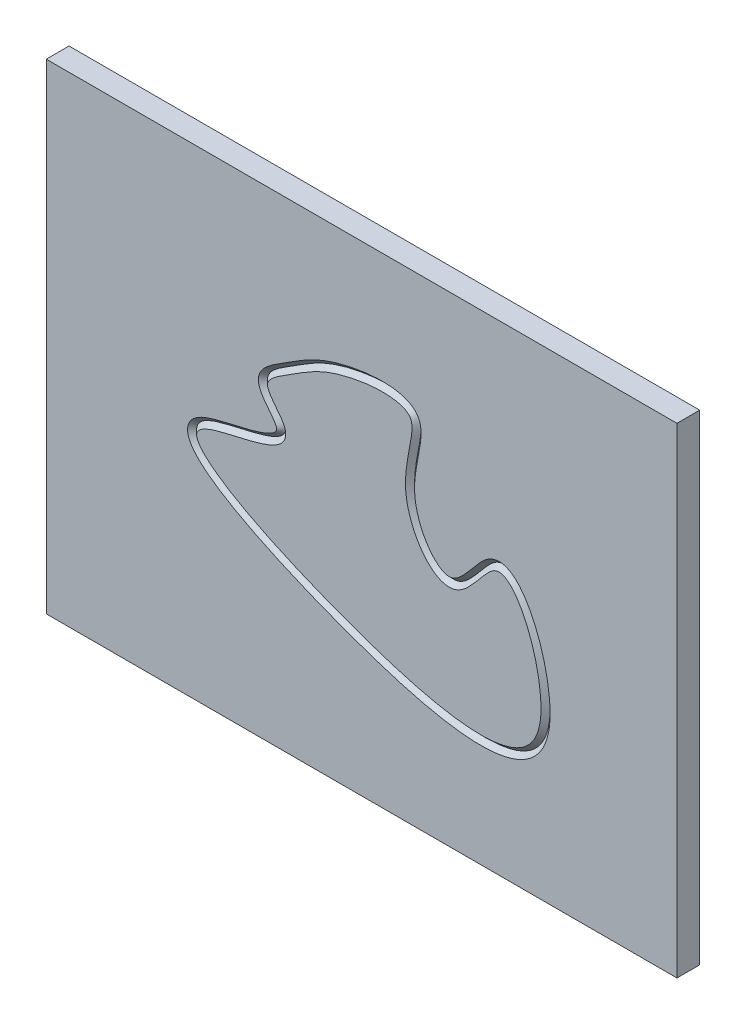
SolidWorks part; units mm, degrees
ref_plane "Ebene vorne" through (0, 0, 0) normal (0, 0, 1) x (1, 0, 0)
ref_plane "Ebene oben" through (0, 0, 0) normal (0, 1, 0) x (1, 0, 0)
ref_plane "Ebene rechts" through (0, 0, 0) normal (1, 0, 0) x (0, 0, -1)
sketch "Skizze1" plane through (0, 0, 0) normal (0, 0, 1) x (1, 0, 0)
  spline S0 degree 3 poles (-51.7272, 25.3453) (-22.7722, 42.3198) (1.6691, 59.6563) (75.1071, 68.8374) (42.3265, 9.6834) (81.4354, -46.2981) (117.8956, 27.7025) (176.6626, -129.1381) (27.6181, -102.5298) (-144.2549, -15.805) (-10.2703, -7.8477) (-51.7272, 25.3453) (-22.7722, 42.3198) (1.6691, 59.6563) knots -0.155107 -0.070279 -0.033976 0 0.0464 0.137758 0.21113 0.282467 0.336367 0.456896 0.666948 0.844893 0.929721 0.966024 1 1.0464 1.137758 1.21113 only from (-27.3754, 39.8728) to (-27.3754, 39.8728)
sketch "Skizze2" plane through (0, 0, 0) normal (0, 0, 1) x (1, 0, 0)
  line L1 (-185.3576, 137.4934) -> (229.9673, 137.4934)
  line L2 (-185.3576, 137.4934) -> (-185.3576, -178.8422)
  line L3 (-185.3576, -178.8422) -> (229.9673, -178.8422)
  line L4 (229.9673, 137.4934) -> (229.9673, -178.8422)
extrude "Linear austragen1" add sketch "Skizze2" against normal blind 15
ref_plane "Ebene1" through (-27.3754, 39.8728, 0) normal (-0.8489, -0.5286, 0) x (0, 0, 1)
sketch "Skizze4" plane through (-27.3754, 39.8728, 0) normal (-0.8489, -0.5286, 0) x (0, 0, 1)
sketch_block_instance "V-1"
sketch_block "V" parameters "D1"=90, "D2"=3
sweep "Schnitt-Austragung3" cut profiles "Skizze4" path "Skizze1"
equation "\"LÄNGE\"=0"
equation "\"BREITE\"=0"
equation "\"HÖHE\"=0"
equation "\"DURCHMESSER\"=0"
equation "\"Stückzahl\"= 1"
